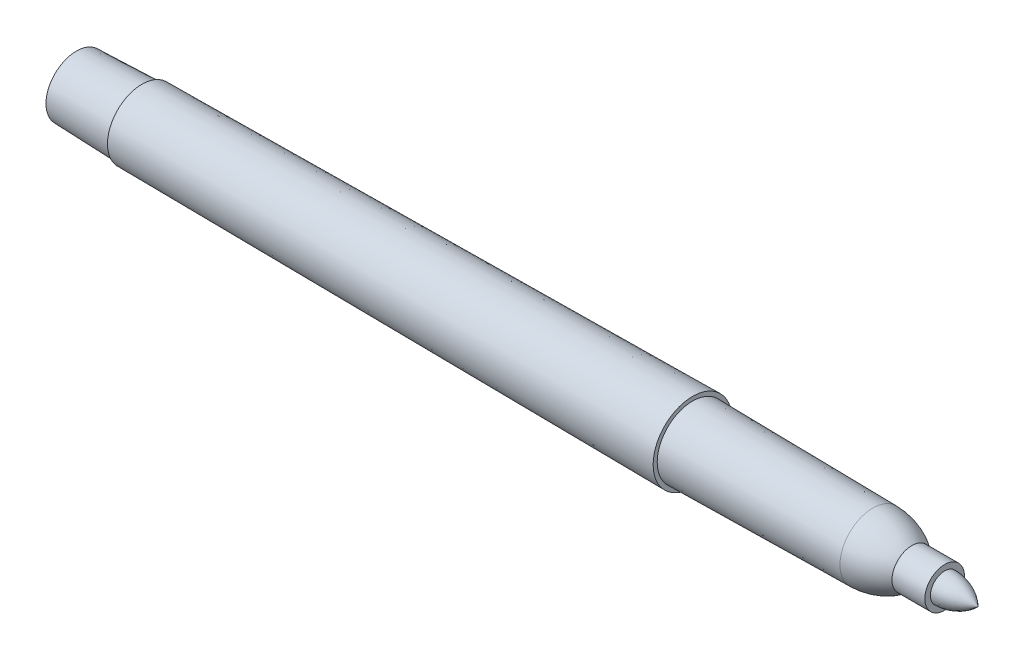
SolidWorks part; units mm, degrees
ref_plane "Front Plane" through (0, 0, 0) normal (0, 0, 1) x (1, 0, 0)
ref_plane "Top Plane" through (0, 0, 0) normal (0, 1, 0) x (1, 0, 0)
ref_plane "Right Plane" through (0, 0, 0) normal (1, 0, 0) x (0, 0, -1)
sketch "Sketch1" plane through (0, 0, 0) normal (0, 1, 0) x (1, 0, 0)
  line L0 (0, 0) -> (127, 0)
  line L1 (122.301, 2.0066) -> (122.301, 2.794)
  line L2 (122.301, 2.794) -> (117.6782, 2.794)
  line L4 (86.7918, 4.9784) -> (86.7918, 5.5499)
  line L5 (86.7918, 5.5499) -> (9.2456, 4.8641)
  line L6 (0, 0) -> (0, 4.2799)
  line L7 (0, 4.2799) -> (9.2456, 4.5847)
  line L8 (9.2456, 4.5847) -> (9.2456, 4.8641)
  line L9 (86.7918, 4.9784) -> (112.1918, 4.6355)
  arc A0 (127, 0) -> (122.301, 2.0066) centre (122.2583, -4.5986) ccw
  arc A1 (112.1918, 4.6355) -> (117.6782, 2.794) centre (112.0639, -4.8392) cw
  point P8 (0, 0)
  dimension "D4" = 4.6228
  dimension "D8" = 5.4864
  dimension "D1" = 127
  dimension "D2" = 4.699
  dimension "D3" = 2.0066
  dimension "D5" = 2.794
  dimension "D6" = 4.6355
  dimension "D7" = 30.8864
  dimension "D9" = 5.5499
  dimension "D10" = 9.2456
  dimension "D11" = 4.5847
  dimension "D12" = 4.2799
  dimension "D13" = 4.8641
  dimension "D14" = 4.9784
revolve "Revolve1" add sketch "Sketch1" angle 360 about L0
